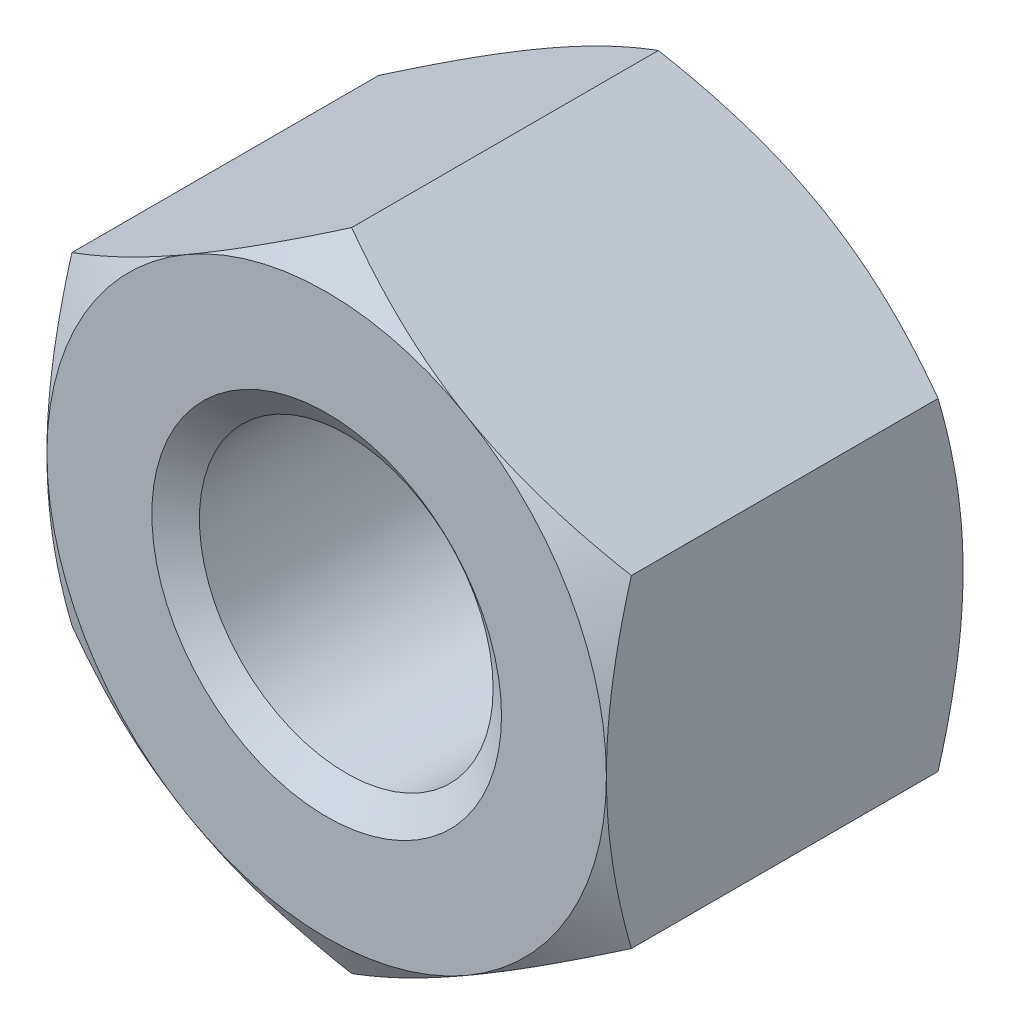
SolidWorks part; units mm, degrees
ref_plane "Plane1" through (0, 0, 0) normal (0, 0, 1) x (1, 0, 0)
ref_plane "Plane2" through (0, 0, 0) normal (0, 1, 0) x (1, 0, 0)
ref_plane "Plane3" through (0, 0, 0) normal (1, 0, 0) x (0, 0, -1)
revolve "EndChamfer" cut sketch "Sketch5"
sketch "Sketch5"
  line L0 (5.0746, 2.5) -> (4.7665, 2.06)
  line L1 (5.1254, 2.5) -> (5.0746, 2.5)
  line L2 (5.1254, 2.5) -> (5.1254, 2.06)
  line L3 (5.1254, 2.06) -> (4.7665, 2.06)
  line L6 (-0.0508, 2.5) -> (0, 2.5)
  line L7 (0, 2.5) -> (0.3081, 2.06)
  line L9 (0.3081, 2.06) -> (-0.0508, 2.06)
  line L10 (-0.0508, 2.06) -> (-0.0508, 2.5)
  line L11 (25.0375, 0) -> (38.388, 0) construction
  line L12 (5.1, 0) -> (0, 0) construction
extrude "BaseNut" add sketch "BaseNutSke" against normal blind 5.1
sketch "BaseNutSke" plane through (0, 0, 0) normal (0, 0, 1) x (1, 0, 0)
  line L6 (4, 2.3094) -> (4, -2.3094)
  line L7 (-4, 2.3094) -> (-4, -2.3094)
  line L8 (4, 2.3094) -> (0, 4.6188)
  line L9 (0, 4.6188) -> (-4, 2.3094)
  line L10 (-4, -2.3094) -> (0, -4.6188)
  line L11 (0, -4.6188) -> (4, -2.3094)
  circle A0 centre (0, 0) radius 2.1
  dimension "D4" = 4
  dimension "Tap_drill" = 4.2
  dimension "D1" = 120
  dimension "D2" = 4
  dimension "D3" = 4
  dimension "Width_flats" = 8
pattern_linear "ThdSchPat"
revolve "ThreadSchematic" cut sketch "ThdSchSke" angle 360 about L11
sketch "ThdSchSke" plane through (0, 0, 0) normal (0, 1, 0) x (1, 0, 0)
  line L0 (-2.5, 0.0254) -> (-2.1, 0.3055)
  line L1 (-2.1, 0.3055) -> (-1.05, 0.3055)
  line L2 (-1.05, 0.3055) -> (-1.05, -0.2547)
  line L3 (-1.05, -0.2547) -> (-2.1, -0.2547)
  line L4 (-2.1, -0.2547) -> (-2.5, 0.0254)
  line L5 (-3.175, 0.8) -> (3.175, 0.8) construction
  line L6 (0, 0.8) -> (0, -2.9874) construction
  line L7 (0, 4.7945) -> (0, 0.2801) construction
  dimension "D1" = 35
  dimension "VeeAngle" = 70
  dimension "SideAngle" = 55
  dimension "D2" = 0.0508
  dimension "OverCut" = 2.1
  dimension "Tap_Drill" = 4.2
  dimension "Advance" = 0.7213
  dimension "Thread_major" = 5
  dimension "Num_threads" = 8
  dimension "D4" = 50
  dimension "Offset1" = 5.1254
  dimension "ThreadMajor" = 2.5
  dimension "ChamferDepth" = 0.44
  dimension "Offset2" = 5.1762
sketch "Sketch4" plane through (0, 0, 0) normal (1, 0, 0) x (0, 0, -1)
  line L0 (5.1, 4) -> (5.09, 4)
  line L1 (5.1, 4) -> (5.1, 14.6188)
  line L2 (5.09, 14.6188) -> (5.1, 14.6188)
  line L3 (5.09, 14.6188) -> (5.09, 4)
  line L4 (0, 0) -> (34.925, 0) construction
  line L6 (5.1, 2.3094) -> (5.1, 4.6188) construction
  line L7 (0, 4) -> (-10, 4)
  line L8 (0, 2.3094) -> (0, 4.6188) construction
  line L9 (0.3573, 4.6188) -> (0.3573, 14.6188)
  line L10 (0.3573, 14.6188) -> (-10, 14.6188)
  line L11 (-10, 14.6188) -> (-10, 4)
  line L12 (0, 4) -> (0.3573, 4.6188)
  line L14 (0, 2.3094) -> (0, -2.3094) construction
  line L15 (5.1, 4.6188) -> (0, 4.6188) construction
  dimension "D1" = 4
  dimension "D2" = 30
  dimension "Bearing_ht" = 0.01
  dimension "D3" = 10
  dimension "D4" = 10
revolve "Bearing-Face" cut sketch "Sketch4" angle 360 about L4
sketch "Sketch3" plane through (0, 0, 0) normal (1, 0, 0) x (0, 0, -1)
  line L0 (5.1, 4) -> (4.7427, 4.6188)
  line L1 (4.7427, 4.6188) -> (4.7427, 14.6188)
  line L2 (4.7427, 14.6188) -> (15.1, 14.6188)
  line L3 (15.1, 14.6188) -> (15.1, 4)
  line L4 (15.1, 4) -> (5.1, 4)
  line L5 (5.1, 2.3094) -> (5.1, 4.6188) construction
  line L6 (5.1, 4.6188) -> (0, 4.6188) construction
  line L7 (0, 0) -> (38.6776, 0) construction
  line L8 (5.1, 0) -> (0, 0) construction
  line L9 (2.55, 4.6188) -> (2.55, 44.222) construction
  line L10 (0.3573, 14.6188) -> (-10, 14.6188)
  line L11 (-10, 14.6188) -> (-10, 4)
  line L12 (-10, 4) -> (0, 4)
  line L13 (0, 4) -> (0.3573, 4.6188)
  line L14 (0.3573, 4.6188) -> (0.3573, 14.6188)
  line L16 (5.1, 4.6188) -> (0, 4.6188) construction
  dimension "D1" = 4
  dimension "D2" = 30
  dimension "D3" = 10
  dimension "D4" = 10
revolve "Double-Chamfer" cut sketch "Sketch3" angle 360 about L7
equation "\"D2@BaseNutSke\" = \"Width_flats@BaseNutSke\" / 2"
equation "\"D3@BaseNutSke\" = \"Width_flats@BaseNutSke\" / 2"
equation "\"D1@Sketch3\" = \"Width_flats@BaseNutSke\" /2"
equation "\"D1@Sketch4\" = \"D2@BaseNutSke\""
equation "\"D4@BaseNutSke\" = \"D3@BaseNutSke\""
equation "\"Thread_major@ThdSchSke\" = \"Thread_major@ThreadCosmetic\""
equation "\"Tap_drill@ThdSchSke\" = \"Tap_drill@BaseNutSke\""
equation "\"Overcut@ThdSchSke\" = \"Tap_drill@ThdSchSke\" * 0.5"
equation "\"Num_threads@ThdSchPat\" = int(  ( \"Thickness@BaseNut\" - 0.0508 ) / \"Advance@ThdSchSke\" + 0.999 )  + 1"
equation "\"Advance@ThdSchPat\" = ( \"Thickness@BaseNut\" - 0.0508 ) /  (\"Num_threads@ThdSchPat\" - 1) 'relax it"
equation "' \"Num_threads@ThdSchPat\" = \"Num_threads@ThdSchPat\" - sgn( \"Num_threads@ThdSchPat\" - 1) '---chamfered tips only---"
equation "\"ThreadMajor@Sketch5\" = \"Thread_major@ThreadCosmetic\" * 0.5"
equation "\"ChamferDepth@Sketch5\" = (\"Thread_major@ThreadCosmetic\" - \"Tap_drill@BaseNutSke\") * 0.55"
equation "\"Offset1@Sketch5\" = \"Thickness@BaseNut\" + 0.0254"
equation "\"Offset2@Sketch5\" = \"Offset1@Sketch5\" + 0.0508"
